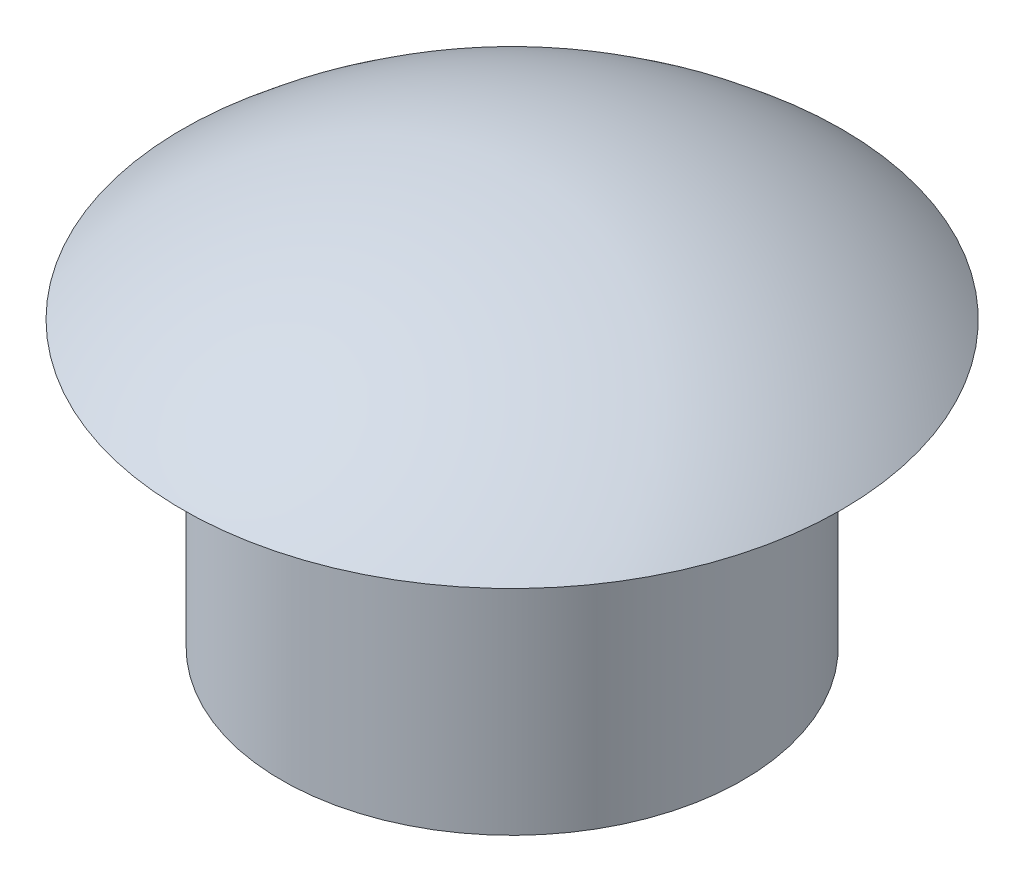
SolidWorks part; units mm, degrees
ref_plane "Face" through (0, 0, 0) normal (0, 0, 1) x (1, 0, 0)
ref_plane "Dessus" through (0, 0, 0) normal (0, 1, 0) x (1, 0, 0)
ref_plane "Droite" through (0, 0, 0) normal (1, 0, 0) x (0, 0, -1)
sketch "Esquisse1" plane through (0, 0, 0) normal (0, 0, 1) x (1, 0, 0)
  line L0 (0, 0) -> (0, 23.063) construction
  line L1 (0, 4) -> (1.75, 4)
  line L2 (1.75, 4) -> (1.75, 0)
  line L3 (1.75, 0) -> (3.25, 0)
  line L4 (3.25, 0) -> (3.25, 4)
  line L5 (3.25, 4) -> (4.6457, 4)
  line L6 (0, 5.7451) -> (0, 4)
  arc A0 (4.6457, 4) -> (0, 5.7451) centre (0, -1.3113) ccw
  dimension "D1" = 6.5
  dimension "D2" = 4
  dimension "D3" = 1.5
revolve "Révolution1" add sketch "Esquisse1" angle 360 about L0
